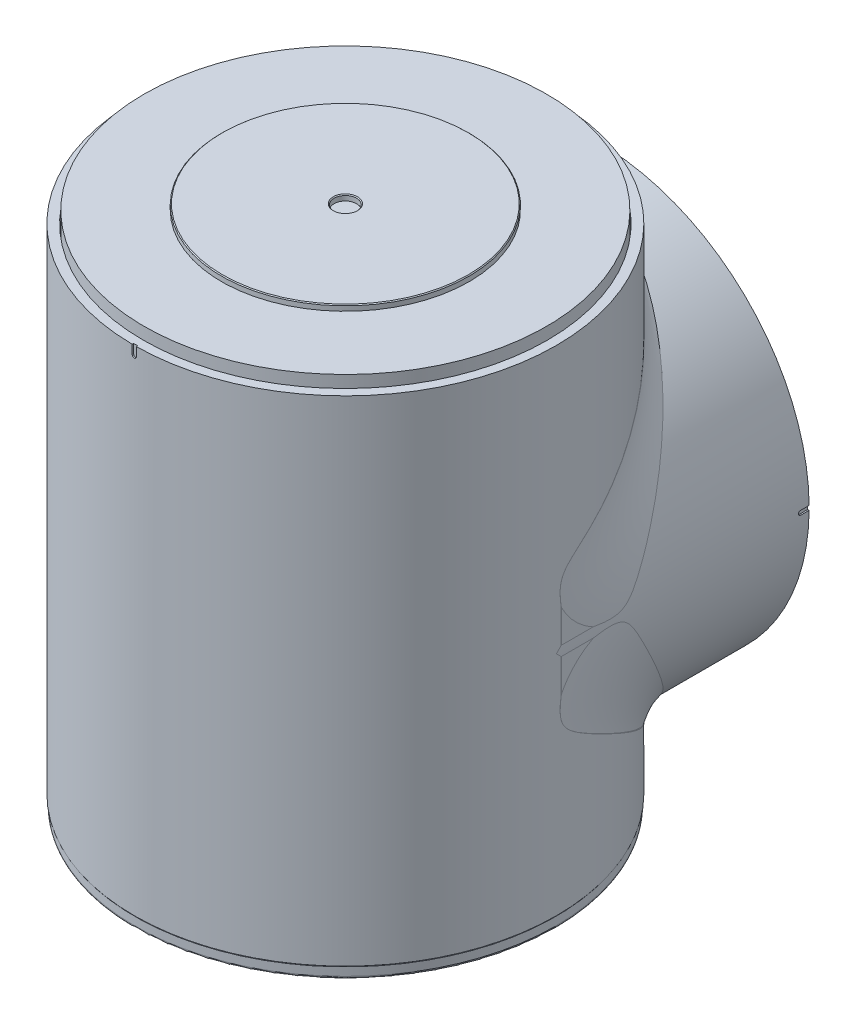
SolidWorks part; units mm, degrees
other "<32关节后盖>-<凸台-拉伸1>"
other "<4.0.07.2008583>-<凸台-拉伸1>"
other "<4.0.07.2008583>-<凸台-拉伸1>"
other "<4.0.07.2008583>-<凸台-拉伸1>"
other "<4.0.07.2008583>-<凸台-拉伸1>"
ref_plane "前视基准面" through (0, 0, 0) normal (0, 0, 1) x (1, 0, 0)
ref_plane "上视基准面" through (0, 0, 0) normal (0, 1, 0) x (1, 0, 0)
ref_plane "右视基准面" through (0, 0, 0) normal (1, 0, 0) x (0, 0, -1)
imported_body "7.7.00.8050032.STEP"
sketch "草图2" plane through (0, 0, -86.3) normal (0, 0, -1) x (-1, 0, 0)
  circle A1 centre (0, -39) radius 71.5 construction
  circle A2 centre (0, -39) radius 71.5
extrude "切除-拉伸1" cut sketch "草图2" against normal blind 0.3
sketch "草图3" plane through (0, 56, 0) normal (0, 1, 0) x (1, 0, 0)
  line L6 (-0.75, -74.9962) -> (-0.75, -74.5)
  line L7 (-0.75, -74.5) -> (0.75, -74.5)
  line L8 (0.75, -74.5) -> (0.75, -74.9962)
  line L9 (0.75, 74.9962) -> (0.75, 74.5)
  line L10 (0.75, 74.5) -> (-0.75, 74.5)
  line L11 (-0.75, 74.5) -> (-0.75, 74.9962)
  line L12 (-0.75, -74.9962) -> (-0.75, -74.5)
  line L13 (-0.75, -74.5) -> (0.75, -74.5)
  line L14 (0.75, -74.5) -> (0.75, -74.9962)
  line L15 (0.75, 74.9962) -> (0.75, 74.5)
  line L16 (0.75, 74.5) -> (-0.75, 74.5)
  line L17 (-0.75, 74.5) -> (-0.75, 74.9962)
  circle A0 centre (0, 0) radius 71.8 construction
  circle A1 centre (0, 0) radius 71.8
  arc A2 (0.75, -74.9962) -> (0.75, 74.9962) centre (0, 0) ccw
  arc A3 (-0.75, 74.9962) -> (-0.75, -74.9962) centre (0, 0) ccw
  arc A4 (0.75, -74.9962) -> (0.75, 74.9962) centre (0, 0) ccw
  arc A5 (-0.75, 74.9962) -> (-0.75, -74.9962) centre (0, 0) ccw
  dimension "D1" = 0
extrude "切除-拉伸3" cut sketch "草图3" against normal blind 0.1
sketch "草图5" plane through (0, 0, -90) normal (0, 0, -1) x (-1, 0, 0)
  circle A0 centre (0, -39) radius 113.8455
extrude "切除-拉伸4" cut sketch "草图5" against normal blind 0.2
sketch "草图6" plane through (0, 0, 0) normal (1, 0, 0) x (0, 0, -1)
  line L0 (-74.5, -120) -> (74.5, -120) construction
  line L1 (-95.749, -120) -> (143.8503, -120)
  line L2 (-95.749, -120) -> (-95.749, -187.5537)
  line L3 (-95.749, -187.5537) -> (143.8503, -187.5537)
  line L4 (143.8503, -120) -> (143.8503, -187.5537)
extrude "切除-拉伸5" cut sketch "草图6" against normal mid plane 460
sketch "草图7" plane through (0, 0, -86) normal (0, 0, -1) x (-1, 0, 0)
  circle A0 centre (0, -39) radius 71.5
extrude "凸台-拉伸2" add sketch "草图7" against normal up to surface (61.7513 mm away)
combine bodies "组合5" operation type add bodies to combine 104 103
combine bodies "组合6" operation type add bodies to combine 109 110
delete or keep bodies "实体-删除/保留 1" type delete bodies bodies 102
other "删除面1"
ref_plane "基准面16" through (0, 0, 0) normal (0.7071, 0, -0.7071) x (0, 1, 0)
ref_plane "基准面1" through (0, 0, 25.5) normal (0, 0, 1) x (1, 0, 0)
ref_plane "前视基准面-32关节后盖" through (0, -100.2, 0) normal (0, -1, 0) x (0.7071, 0, 0.7071)
ref_plane "上视基准面-32关节后盖" through (0, -100.2, 0) normal (-0.7071, 0, 0.7071) x (0.7071, 0, 0.7071)
ref_plane "右视基准面-32关节后盖" through (0, -100.2, 0) normal (0.7071, 0, 0.7071) x (0, 1, 0)
ref_plane "基准面1-32关节后盖" through (0, -125.7, 0) normal (0, -1, 0) x (0.7071, 0, 0.7071)
ref_plane "基准面2-32关节后盖" through (0, -100.2, 0) normal (-1, 0, 0) x (0, -1, 0)
inserted part "32关节后盖"
move or copy body "实体-移动/复制5" placed by mates yes
ref_plane "前视基准面-4.0.07.2008583" through (-48.7904, -124.45, -48.7904) normal (0, 0, 1) x (0, 1, 0)
ref_plane "上视基准面-4.0.07.2008583" through (-48.7904, -124.45, -48.7904) normal (-1, 0, 0) x (0, 1, 0)
ref_plane "右视基准面-4.0.07.2008583" through (-48.7904, -124.45, -48.7904) normal (0, 1, 0) x (0, 0, -1)
sketch "草图1-4.0.07.2008583" plane through (-48.7904, -122.8, -48.7904) normal (0, 1, 0) x (0, 0, -1)
  circle A0 centre (0, 0) radius 1.5
sketch "草图22" plane through (0, -122.3, 0) normal (0, -1, 0) x (1, 0, 0)
  circle A0 centre (-48.7904, 48.7904) radius 1.7
  circle A1 centre (48.7904, 48.7904) radius 1.7
  circle A2 centre (48.7904, -48.7904) radius 1.7
  circle A3 centre (-48.7904, -48.7904) radius 1.7
extrude "切除-拉伸6" [suppressed] cut sketch "草图22" against normal blind 10
inserted part "4.0.07.2008583"
move or copy body "实体-移动/复制7" placed by mates yes parameters "D1.凸台-拉伸1"=10
other "距离1" parameters "D1"=0.5
ref_plane "前视基准面-4.0.07.20085832" through (48.7904, -124.45, -48.7904) normal (0, 0, 1) x (0, 1, 0)
ref_plane "上视基准面-4.0.07.20085832" through (48.7904, -124.45, -48.7904) normal (-1, 0, 0) x (0, 1, 0)
ref_plane "右视基准面-4.0.07.20085832" through (48.7904, -124.45, -48.7904) normal (0, 1, 0) x (0, 0, -1)
sketch "草图1-4.0.07.20085832" plane through (48.7904, -122.8, -48.7904) normal (0, 1, 0) x (0, 0, -1)
  circle A0 centre (0, 0) radius 1.5
inserted part "4.0.07.20085832"
move or copy body "实体-移动/复制9" placed by mates yes parameters "D1.凸台-拉伸1"=10
other "距离2" parameters "D1"=0.5
ref_plane "前视基准面-4.0.07.20085833" through (48.7904, -124.45, 48.7904) normal (0, 0, 1) x (0, 1, 0)
ref_plane "上视基准面-4.0.07.20085833" through (48.7904, -124.45, 48.7904) normal (-1, 0, 0) x (0, 1, 0)
ref_plane "右视基准面-4.0.07.20085833" through (48.7904, -124.45, 48.7904) normal (0, 1, 0) x (0, 0, -1)
sketch "草图1-4.0.07.20085833" plane through (48.7904, -122.8, 48.7904) normal (0, 1, 0) x (0, 0, -1)
  circle A0 centre (0, 0) radius 1.5
inserted part "4.0.07.20085833"
move or copy body "实体-移动/复制11" placed by mates yes parameters "D1.凸台-拉伸1"=10
other "距离3" parameters "D1"=0.5
ref_plane "前视基准面-4.0.07.20085834" through (-48.7904, -124.45, 48.7904) normal (0, 0, 1) x (0, 1, 0)
ref_plane "上视基准面-4.0.07.20085834" through (-48.7904, -124.45, 48.7904) normal (-1, 0, 0) x (0, 1, 0)
ref_plane "右视基准面-4.0.07.20085834" through (-48.7904, -124.45, 48.7904) normal (0, 1, 0) x (0, 0, -1)
sketch "草图1-4.0.07.20085834" plane through (-48.7904, -122.8, 48.7904) normal (0, 1, 0) x (0, 0, -1)
  circle A0 centre (0, 0) radius 1.5
inserted part "4.0.07.20085834" parameters "D1.凸台-拉伸1"=10
move or copy body "实体-移动/复制13"
other "距离4" parameters "D1"=0.5
combine bodies "组合14" operation type add bodies to combine 112 123 128 129 130 131
